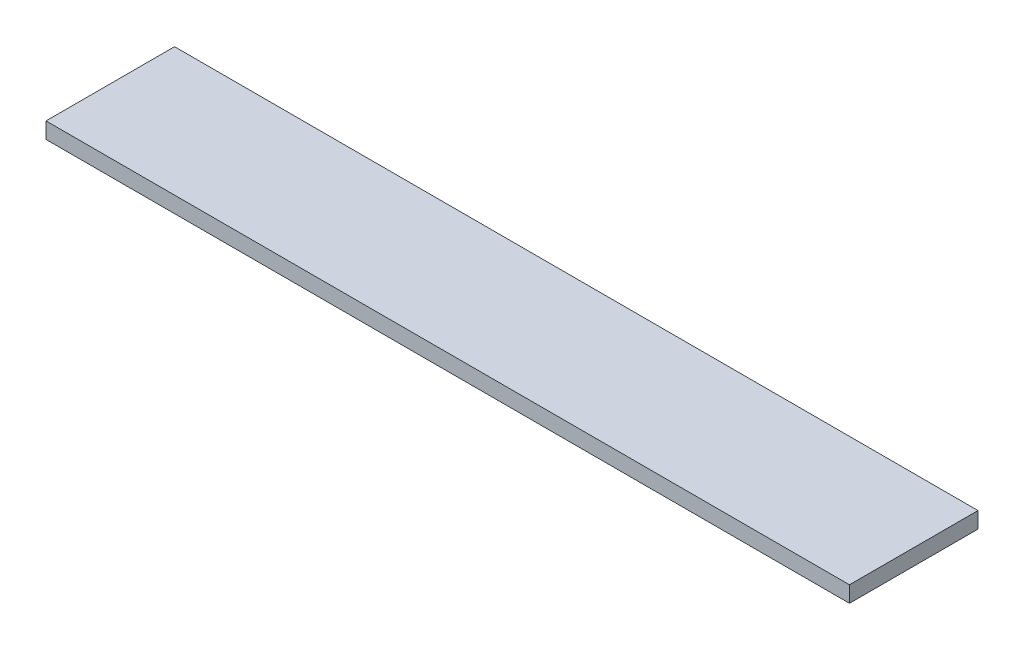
SolidWorks part; units mm, degrees
ref_plane "Alzado" through (0, 0, 0) normal (0, 0, 1) x (1, 0, 0)
ref_plane "Planta" through (0, 0, 0) normal (0, 1, 0) x (1, 0, 0)
ref_plane "Vista lateral" through (0, 0, 0) normal (1, 0, 0) x (0, 0, -1)
sketch "Croquis1" plane through (0, 0, 0) normal (0, 0, 1) x (1, 0, 0)
  line L0 (-500, 173.6398) -> (0, 173.6398)
  line L1 (-500, 173.6398) -> (-500, 163.6398)
  line L2 (0, 173.6398) -> (0, 163.6398)
  line L3 (-500, 163.6398) -> (0, 163.6398)
  dimension "D1" = 10
extrude "Saliente-Extruir1" add sketch "Croquis1" along normal blind 80
